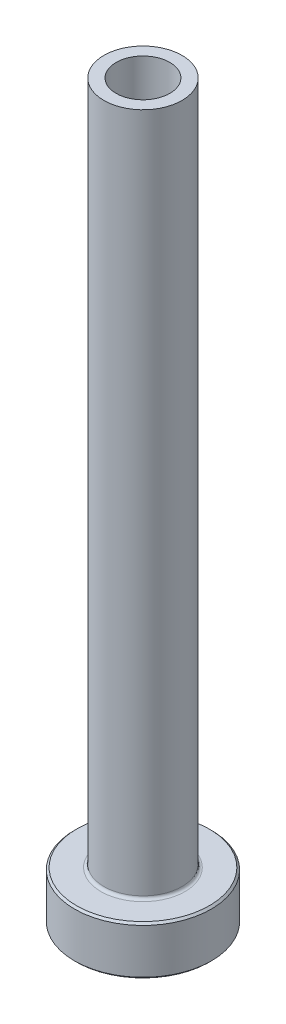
SolidWorks part; units mm, degrees
ref_plane "Front Plane" through (0, 0, 0) normal (0, 0, 1) x (1, 0, 0)
ref_plane "Top Plane" through (0, 0, 0) normal (0, 1, 0) x (1, 0, 0)
ref_plane "Right Plane" through (0, 0, 0) normal (1, 0, 0) x (0, 0, -1)
sketch "Sketch1" plane through (0, 0, 0) normal (0, 0, 1) x (1, 0, 0)
  line L0 (-2.75, 75) -> (-4, 75)
  line L1 (-4, 75) -> (-4, 5)
  line L2 (-4, 5) -> (-7, 5)
  line L3 (-7, 5) -> (-7, 0)
  line L4 (7.7, 0) -> (-7.7, 0) construction
  line L5 (-7, 0) -> (-3, 0)
  line L6 (-2.75, 30) -> (-2.75, 75)
  line L7 (0, 92.1877) -> (0, -15.5353) construction
  line L8 (0, -7.7) -> (0, 7.7) construction
  line L9 (-2.75, 30) -> (-3, 18)
  line L10 (-3, 18) -> (-3, 0)
  dimension "D1" = 0.25
  dimension "ID" = 5.5
  dimension "OD" = 8
  dimension "L" = 75
  dimension "H" = 14
  dimension "T" = 5
  dimension "N" = 45
  dimension "D2" = 12
revolve "Revolve1" add sketch "Sketch1" angle 360 about L7
fillet "Fillet1" radius 0.3 1 edges at (0, 5, 4)
chamfer "Chamfer1" distance 0.2 angle 45 2 edges at (0, 5, 7) (0, 0, 7)
chamfer "Chamfer3" distance 0.5 angle 45 1 edges at (0, 0, 3)
